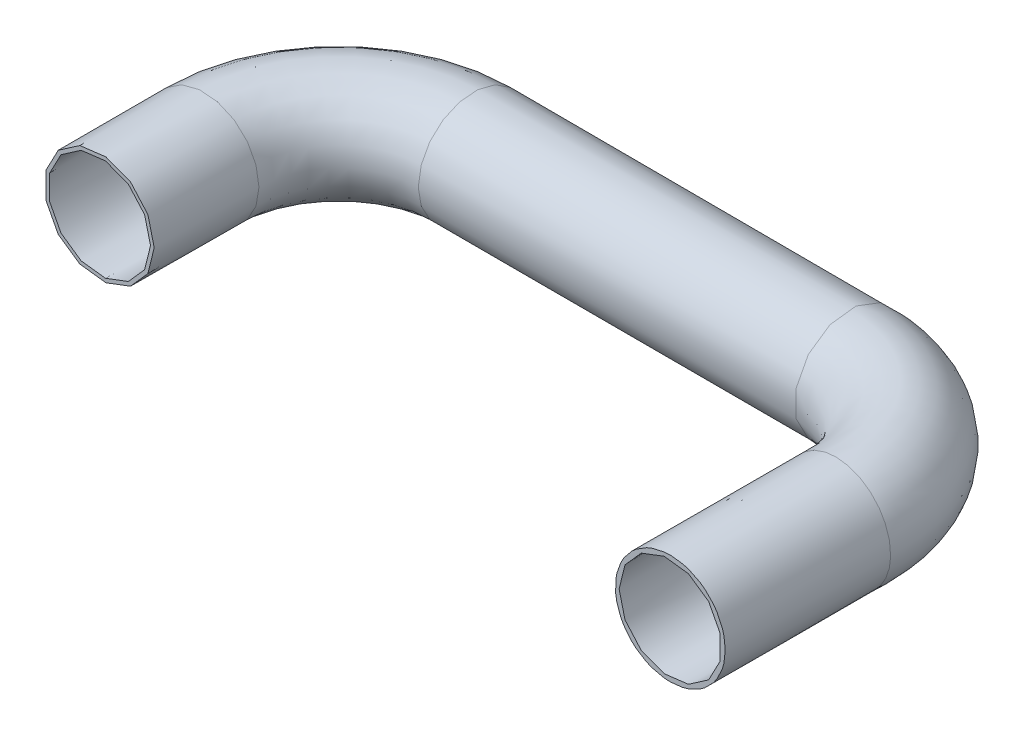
SolidWorks part; units mm, degrees
ref_plane "Front" through (0, 0, 0) normal (0, 0, 1) x (1, 0, 0)
ref_plane "Top" through (0, 0, 0) normal (0, 1, 0) x (1, 0, 0)
ref_plane "Right" through (0, 0, 0) normal (1, 0, 0) x (0, 0, -1)
sketch "Sketch1" plane through (0, 0, 0) normal (0, 1, 0) x (1, 0, 0)
  line L0 (0, 0) -> (0, 28.2696)
  line L1 (36.3105, 64.5801) -> (137.8482, 64.5801)
  line L2 (171.1185, 28.2696) -> (171.1185, -17.0199)
  arc A0 (0, 28.2696) -> (36.3105, 64.5801) centre (36.3105, 28.2696) cw
  arc A1 (137.8482, 64.5801) -> (171.1185, 28.2696) centre (137.8482, 31.1825) cw
sketch "Sketch2" plane through (0, 0, 0) normal (0, 0, 1) x (1, 0, 0)
  circle A0 centre (0, 0) radius 13.8171
sweep "Sweep-Thin1" add profiles "Sketch2" path "Sketch1" parameters "D1"=1
